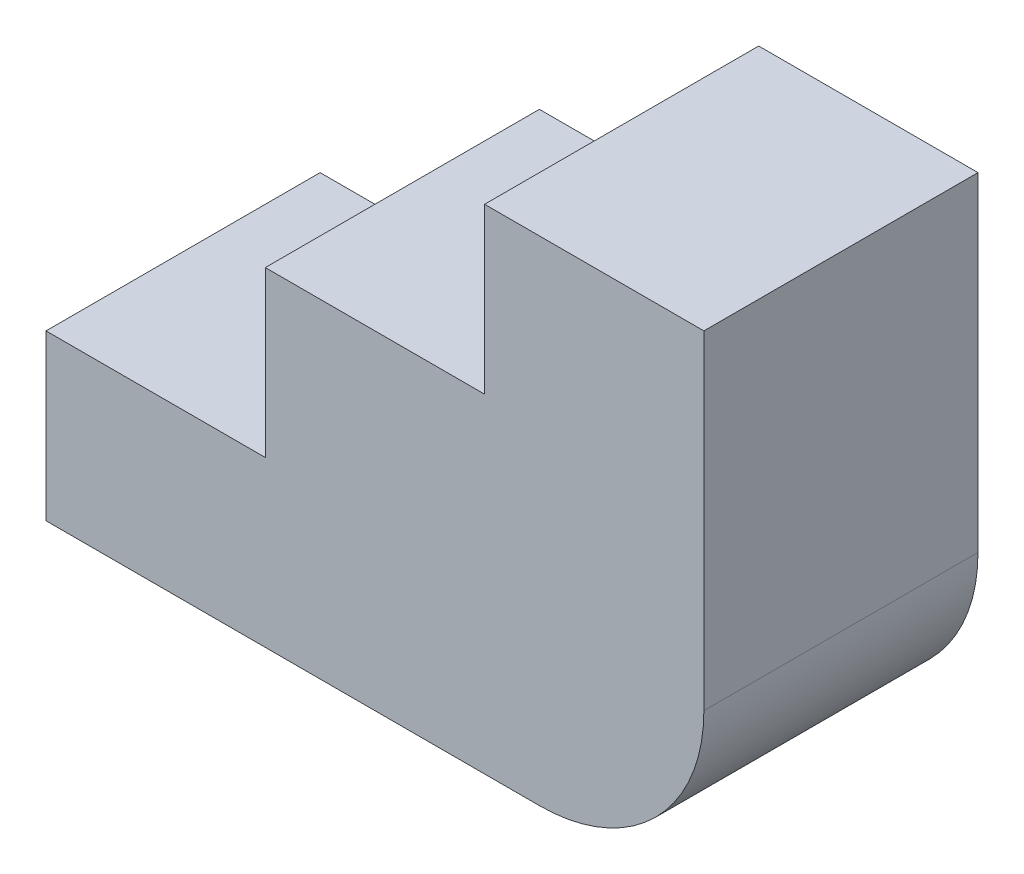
SolidWorks part; units mm, degrees
ref_plane "Plano frontal" through (0, 0, 0) normal (0, 0, 1) x (1, 0, 0)
ref_plane "Plano superior" through (0, 0, 0) normal (0, 1, 0) x (1, 0, 0)
ref_plane "Plano direito" through (0, 0, 0) normal (1, 0, 0) x (0, 0, -1)
sketch "Esboço1" plane through (0, 0, 0) normal (0, 0, 1) x (1, 0, 0)
  line L0 (0, 0) -> (0, -15)
  line L1 (0, -15) -> (45, -15)
  line L2 (0, 0) -> (20, 0)
  line L3 (20, 0) -> (20, 15)
  line L4 (20, 15) -> (40, 15)
  line L5 (40, 15) -> (40, 30)
  line L6 (40, 30) -> (60, 30)
  line L7 (60, 0) -> (60, 30)
  arc A0 (45, -15) -> (60, 0) centre (45, 0) ccw
  point P11 (60, -15)
  dimension "D8" = 15
  dimension "D1" = 15
  dimension "D2" = 20
  dimension "D3" = 15
  dimension "D4" = 20
  dimension "D5" = 15
  dimension "D6" = 20
  dimension "D7" = 60
extrude "Ressalto-extrusão1" add sketch "Esboço1" along normal blind 25
